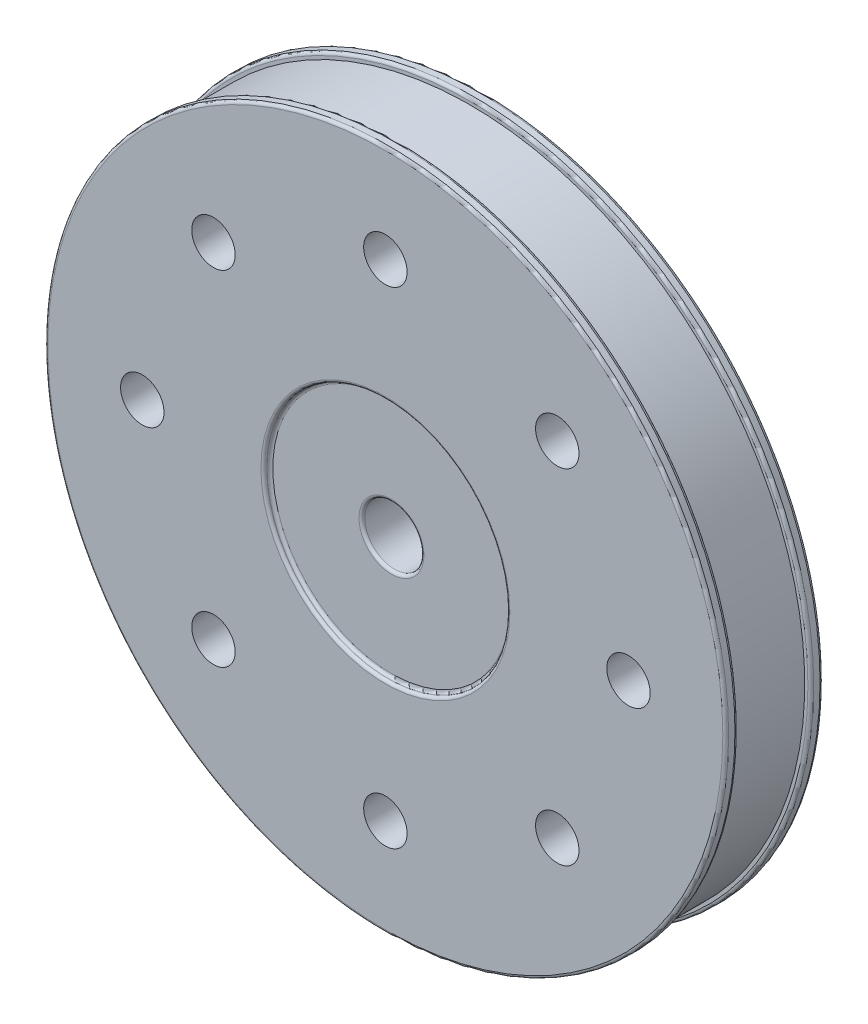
SolidWorks part; units mm, degrees
ref_plane "Front" through (0, 0, 0) normal (0, 0, 1) x (1, 0, 0)
ref_plane "Top" through (0, 0, 0) normal (0, 1, 0) x (1, 0, 0)
ref_plane "Right" through (0, 0, 0) normal (1, 0, 0) x (0, 0, -1)
sketch "Sketch1" plane through (0, 0, 0) normal (1, 0, 0) x (0, 0, -1)
  line L0 (0, 0) -> (-42.8625, 0) construction
  line L1 (-44.45, 31.75) -> (-44.45, 88.9)
  line L2 (-44.45, 88.9) -> (-41.275, 88.9)
  line L3 (-19.05, 88.9) -> (-19.05, 31.75)
  line L4 (-20.6375, 14.2875) -> (0, 14.2875)
  line L5 (0, 14.2875) -> (0, 0)
  line L6 (0, 0) -> (-42.8625, 0)
  line L7 (-44.45, 31.75) -> (-42.8625, 31.75)
  line L8 (-42.8625, 31.75) -> (-42.8625, 0)
  line L9 (0, 0) -> (-79.7169, 0) construction
  line L10 (-41.275, 88.9) -> (-41.275, 87.3125)
  line L11 (-41.275, 87.3125) -> (-22.225, 87.3125)
  line L12 (-22.225, 87.3125) -> (-22.225, 88.9)
  line L13 (-22.225, 88.9) -> (-19.05, 88.9)
  line L14 (-19.05, 31.75) -> (-20.6375, 31.75)
  line L15 (-20.6375, 31.75) -> (-20.6375, 14.2875)
  dimension "D1" = 19.05
  dimension "D2" = 177.8
  dimension "D3" = 25.4
  dimension "D4" = 19.05
  dimension "D5" = 1.5875
  dimension "D6" = 1.5875
  dimension "D7" = 63.5
  dimension "D8" = 28.575
  dimension "D9" = 1.5875
revolve "Revolve1" add sketch "Sketch1" angle 360 about L9
sketch "Sketch2" plane through (0, 0, 42.8625) normal (0, 0, 1) x (1, 0, 0)
  circle A0 centre (0, 0) radius 7.718
extrude "Cut-Extrude1" cut sketch "Sketch2" against normal through all
fillet "Fillet1" radius 0.762 7 edges at (-88.9, 0, 19.05) (-88.9, 0, 22.225) (-88.9, 0, 41.275) (-31.75, 0, 42.8625) (-31.75, 0, 44.45) (-88.9, 0, 44.45) (7.718, 0, 42.8625)
sketch "Sketch3" plane through (0, 0, 44.45) normal (0, 0, 1) x (1, 0, 0)
  circle A0 centre (0, 63.5) radius 5.6727
  dimension "D1" = 63.5
extrude "Cut-Extrude2" cut sketch "Sketch3" against normal through all
pattern_circular "CirPattern1" count 8 over 360 about axis through (0, 0, 0) along (0, 0, 1) of "Cut-Extrude2"
